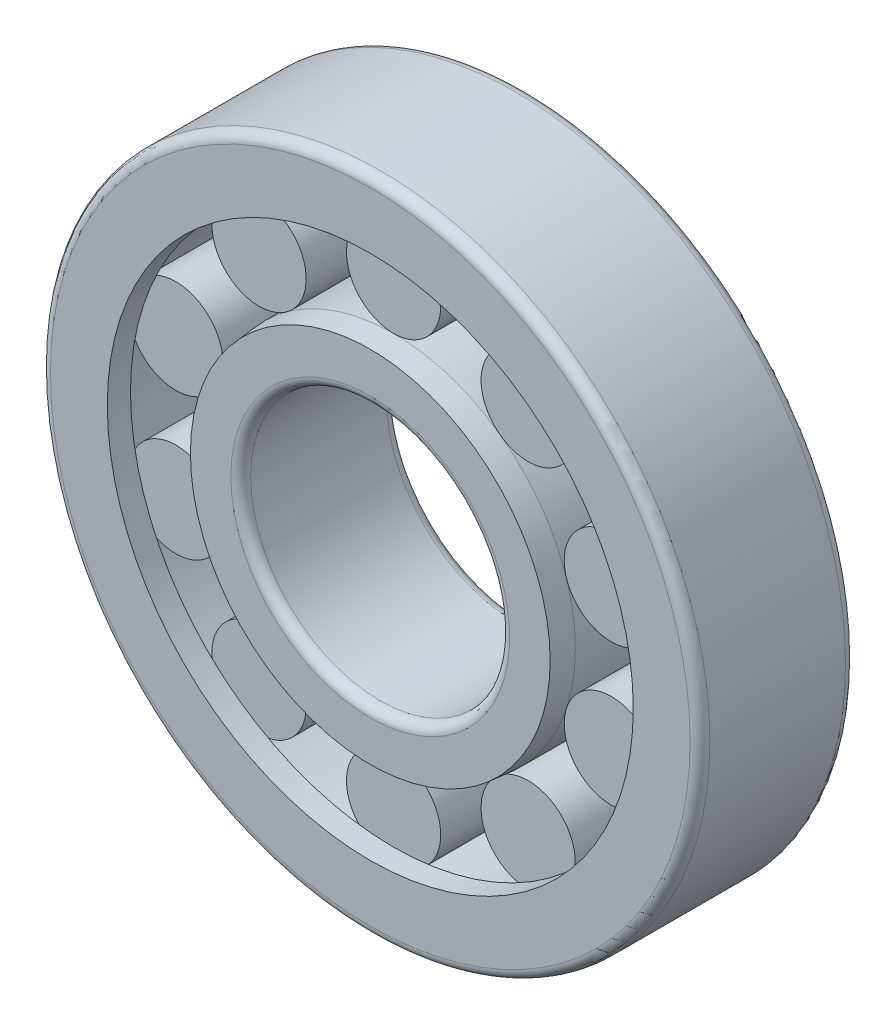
SolidWorks part; units mm, degrees
ref_plane "Front Plane" through (0, 0, 0) normal (0, 0, 1) x (1, 0, 0)
ref_plane "Top Plane" through (0, 0, 0) normal (0, 1, 0) x (1, 0, 0)
ref_plane "Right Plane" through (0, 0, 0) normal (1, 0, 0) x (0, 0, -1)
sketch "BaseSke" plane through (0, 0, 0) normal (1, 0, 0) x (0, 0, -1)
  line L0 (-47.2296, 0) -> (24.6132, 0) construction
  line L1 (-47.2296, 48.6) -> (24.6132, 48.6) construction
  line L2 (0, 129.5214) -> (0, -86.3012) construction
  line L3 (-11.55, 48.6) -> (-11.55, 58.6) construction
  line L4 (-16.5, 70) -> (16.5, 70) construction
  line L5 (-16.5, 27.5) -> (16.5, 27.5) construction
  line L6 (-11.55, 38.6) -> (11.55, 38.6)
  line L7 (-11.55, 38.6) -> (-11.55, 48.6)
  line L8 (-11.55, 48.6) -> (11.55, 48.6)
  line L9 (11.55, 38.6) -> (11.55, 48.6)
  line L10 (-11.55, 58.6) -> (11.55, 58.6) construction
  line L11 (11.55, 58.6) -> (11.55, 48.6) construction
  dimension "D2" = 23.1
  dimension "Bearing_Thickness" = 33
  dimension "Bearing_Outside_Diameter" = 140
  dimension "Bearing_Inside_Diameter" = 55
  dimension "Diameter_Fw" = 77.2
  dimension "Diameter_Ew" = 117.2
revolve "Roller" add sketch "BaseSke" angle 360 about L8
sketch "OuterRaceSke" plane through (0, 0, 0) normal (1, 0, 0) x (0, 0, -1)
  line L0 (0, 0) -> (0, 87.5396) construction
  line L1 (-16.5, 70) -> (16.5, 70)
  line L2 (-16.5, 70) -> (-16.5, 55.8333)
  line L3 (-16.5, 55.8333) -> (-11.575, 55.8333)
  line L4 (16.5, 70) -> (16.5, 55.8333)
  line L5 (-50.3916, 0) -> (55.2197, 0) construction
  line L6 (-11.55, 58.6) -> (11.55, 58.6) construction
  line L7 (11.575, 55.8333) -> (16.5, 55.8333)
  line L9 (-11.575, 55.8333) -> (-11.575, 58.58)
  line L10 (-11.575, 58.58) -> (11.575, 58.58)
  line L11 (11.575, 55.8333) -> (11.575, 58.58)
  dimension "D1" = 23.15
  dimension "D2" = 111.6667
  dimension "D3" = 0.02
revolve "OuterRace" add sketch "OuterRaceSke" angle 360 about L5
sketch "InnerRaceSke" plane through (0, 0, 0) normal (1, 0, 0) x (0, 0, -1)
  line L0 (-70.8626, 0) -> (113.5527, 0) construction
  line L1 (0, 58.441) -> (0, -70.8113) construction
  line L2 (-16.5, 27.5) -> (16.5, 27.5)
  line L3 (-16.5, 27.5) -> (-16.5, 41.6667)
  line L4 (-11.575, 41.6667) -> (-11.575, 38.62)
  line L5 (-11.575, 41.6667) -> (-16.5, 41.6667)
  line L6 (0, 129.5214) -> (0, -86.3012) construction
  line L7 (-11.575, 38.62) -> (11.575, 38.62)
  line L9 (16.5, 27.5) -> (16.5, 41.6667)
  line L10 (11.575, 41.6667) -> (16.5, 41.6667)
  line L11 (11.575, 38.62) -> (11.575, 41.6667)
  line L13 (-11.55, 38.6) -> (11.55, 38.6) construction
  point P17 (0, 27.5)
  dimension "D2" = 0.02
  dimension "D1" = 23.15
  dimension "D3" = 83.3333
revolve "InnerRace" add sketch "InnerRaceSke" angle 360 about L0
fillet "Fillet1" radius 2.1 4 edges at (27.5, 0, 16.5) (70, 0, -16.5) (70, 0, 16.5) (27.5, 0, -16.5)
sketch "NFSke" plane through (0, 0, 0) normal (1, 0, 0) x (0, 0, -1)
  line L0 (-54.6114, 0) -> (63.7655, 0) construction
  line L1 (16.5, 59.0109) -> (11.575, 58.58)
  line L2 (11.575, 58.58) -> (11.575, 55.8333)
  line L3 (11.575, 55.8333) -> (16.5, 55.8333)
  line L4 (16.5, 55.8333) -> (16.5, 59.0109)
  dimension "D1" = 5
revolve "NF" [suppressed] cut sketch "NFSke" angle 360 about L0
mirror "N" [suppressed] about plane through (0, 0, 0) normal (0, 0, 1)
sketch "NJSke" plane through (0, 0, 0) normal (1, 0, 0) x (0, 0, -1)
  line L0 (-35.6078, 0) -> (44.429, 0) construction
  line L1 (16.5, 41.6667) -> (11.575, 41.6667)
  line L2 (11.575, 41.6667) -> (11.575, 38.62)
  line L3 (11.575, 38.62) -> (16.5, 38.1891)
  line L4 (16.5, 38.1891) -> (16.5, 41.6667)
  dimension "D1" = 5
revolve "NJ" cut sketch "NJSke" angle 360 about L0
mirror "NU" about plane through (0, 0, 0) normal (0, 0, 1) of "NJ"
pattern_circular "CirPatternBall" count 10 over 360 about axis through (0, 0, 0) along (0, 0, 1) of "Roller"
sketch "SimplifiedSke" plane through (0, 0, 0) normal (1, 0, 0) x (0, 0, -1)
  line L0 (37.5911, 0) -> (-37.5911, 0) construction
  line L1 (-13.1351, 48.6) -> (13.151, 48.6) construction
  line L2 (-11.55, 58.6) -> (11.55, 58.6)
  line L3 (-11.55, 58.6) -> (-11.55, 38.6)
  line L4 (-11.55, 38.6) -> (11.55, 38.6)
  line L5 (11.55, 58.6) -> (11.55, 38.6)
  line L6 (-47.2296, 48.6) -> (24.6132, 48.6) construction
revolve "Simplified" [suppressed] add sketch "SimplifiedSke" angle 360 about L0
equation "\"D2@BaseSke\" = \"Bearing_Thickness@BaseSke\"*0.7"
equation "\"D1@OuterRaceSke\" = \"Bearing_Thickness@BaseSke\"*0.7+0.05"
equation "\"D2@OuterRaceSke\" =\"Bearing_Outside_Diameter@BaseSke\" -  ( \"Bearing_Outside_Diameter@BaseSke\" - \"Bearing_Inside_Diameter@BaseSke\"  )/ 3 "
equation "\"D1@InnerRaceSke\" = \"Bearing_Thickness@BaseSke\"*0.7+0.05"
equation "\"D3@InnerRaceSke\" = \"Bearing_Inside_Diameter@BaseSke\" +  ( \"Bearing_Outside_Diameter@BaseSke\" - \"Bearing_Inside_Diameter@BaseSke\" ) / 3 "
equation "\"D1@CirPatternBall\" =  int(  ( \"Bearing_Outside_Diameter@BaseSke\" + \"Bearing_Inside_Diameter@BaseSke\" )  / 2 *  pi  /  ( \"Bearing_Outside_Diameter@BaseSke\" - \"Bearing_Inside_Diameter@BaseSke\" ) * 3 ) "
